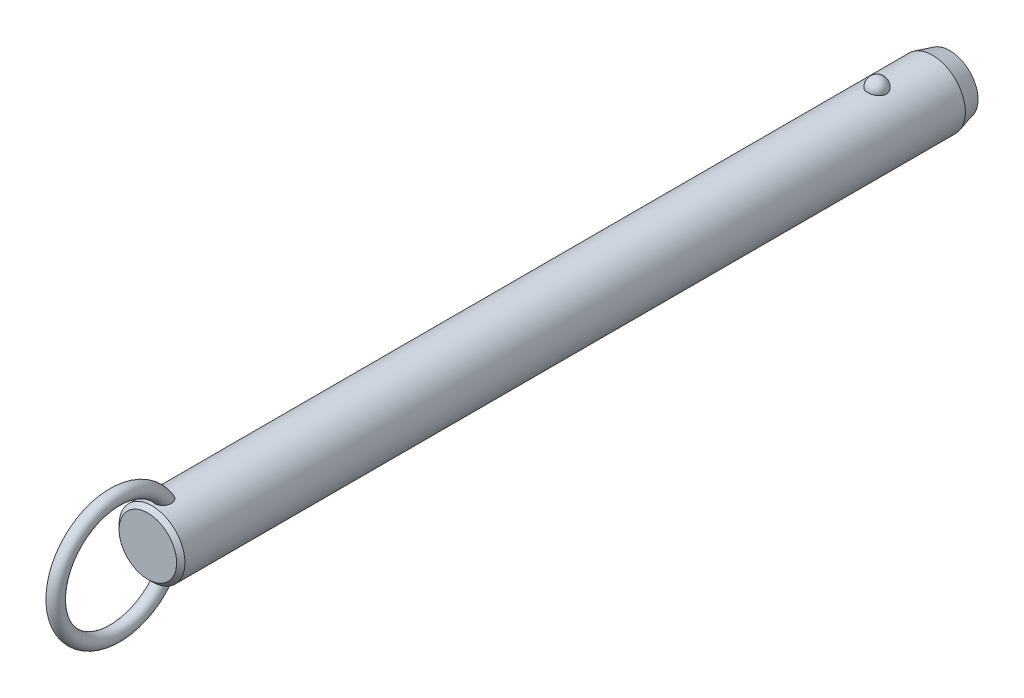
SolidWorks part; units mm, degrees
ref_plane "Front Plane" through (0, 0, 0) normal (0, 0, 1) x (1, 0, 0)
ref_plane "Top Plane" through (0, 0, 0) normal (0, 1, 0) x (1, 0, 0)
ref_plane "Right Plane" through (0, 0, 0) normal (1, 0, 0) x (0, 0, -1)
sketch "Sketch2" plane through (0, 0, 0) normal (0, 0, 1) x (1, 0, 0)
  circle A0 centre (0, 0) radius 9.5
  point P3 (0, 9.5)
  dimension "D1" = 19
extrude "Boss-Extrude1" add sketch "Sketch2" along normal blind 198.12
sketch "Sketch3" plane through (0, 0, 0) normal (0, 0, -1) x (-1, 0, 0)
  circle A0 centre (0, 0) radius 9.5
  dimension "D1" = 19
extrude "Boss-Extrude2" add sketch "Sketch3" along normal blind 23.7
chamfer "Chamfer1" distance 5 angle 15 1 edges at (-9.5, 0, -23.7)
sketch "Sketch12" plane through (0, 0, 0) normal (1, 0, 0) x (0, 0, -1)
  line L0 (-198.12, 9.5) -> (-198.12, -9.5) construction
  point P0 (-198.12, 0)
sketch "Sketch13" plane through (0, 0, 0) normal (1, 0, 0) x (0, 0, -1)
  circle A0 centre (-217.17, 0) radius 19.05
  point P2 (-198.12, 0)
  dimension "D1" = 38.1
sketch "Sketch14" plane through (0, 0, 0) normal (0, 1, 0) x (1, 0, 0)
  circle A0 centre (0, -200.12) radius 2
  point P2 (0, -198.12)
  dimension "D1" = 4
sweep "Sweep1" add profiles "Sketch14" path "Sketch13"
sketch "Sketch15" plane through (0, 0, 198.12) normal (0, 0, 1) x (1, 0, 0)
  circle A0 centre (0, 0) radius 9.5
  dimension "D1" = 19
extrude "Boss-Extrude3" add sketch "Sketch15" along normal blind 9.52
chamfer "Chamfer2" distance 1.2 angle 45 1 edges at (9.5, 0, 207.64)
sketch "Sketch18" plane through (0, 0, 0) normal (1, 0, 0) x (0, 0, -1)
  line L0 (18.7, 9.5) -> (-200.6578, 9.5) construction
  line L1 (2.7, 12.2) -> (2.7, 6.8)
  line L2 (-200.6578, -9.5) -> (18.7, -9.5) construction
  arc A0 (2.7, 12.2) -> (2.7, 6.8) centre (2.7, 9.5) ccw
  point P4 (0, 9.5)
  dimension "D1" = 21.7
revolve "Revolve1" add sketch "Sketch18" angle 360 about L1
